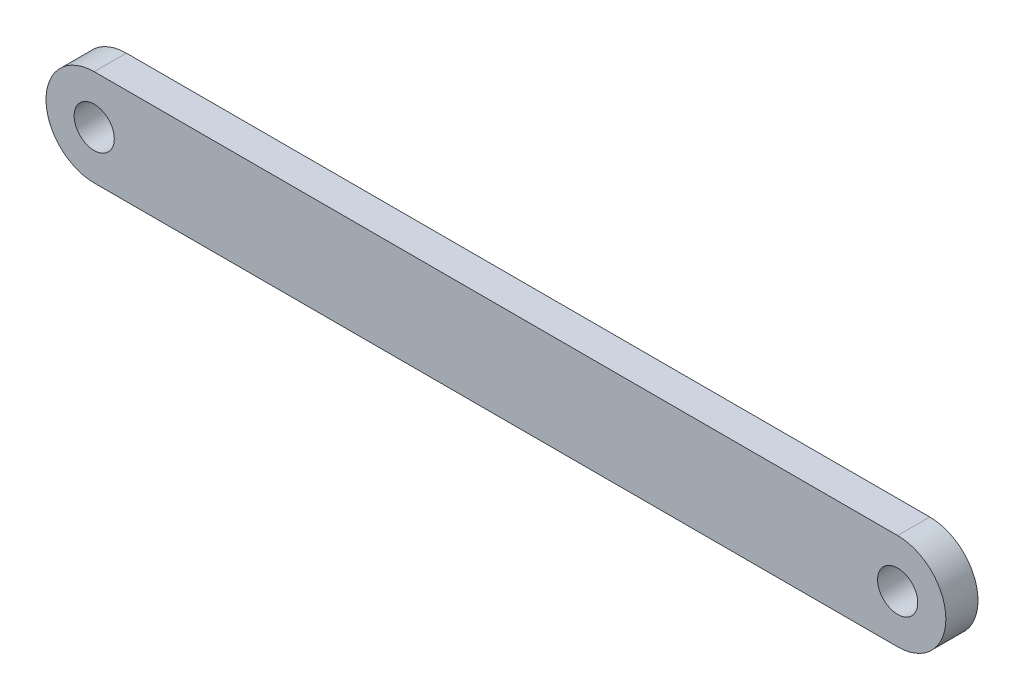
SolidWorks part; units mm, degrees
ref_plane "前视基准面" through (0, 0, 0) normal (0, 0, 1) x (1, 0, 0)
ref_plane "上视基准面" through (0, 0, 0) normal (0, 1, 0) x (1, 0, 0)
ref_plane "右视基准面" through (0, 0, 0) normal (1, 0, 0) x (0, 0, -1)
sketch "草图1" plane through (0, 0, 0) normal (0, 0, 1) x (1, 0, 0)
  line L0 (-50, 0) -> (50, 0) construction
  line L1 (-50, 6) -> (50, 6)
  line L2 (-50, -6) -> (50, -6)
  arc A0 (-50, 6) -> (-50, -6) centre (-50, 0) ccw
  arc A1 (50, -6) -> (50, 6) centre (50, 0) ccw
  circle A2 centre (-50, 0) radius 2.5
  circle A3 centre (50, 0) radius 2.5
  point P2 (0, 0)
extrude "凸台-拉伸1" add sketch "草图1" along normal blind 4
